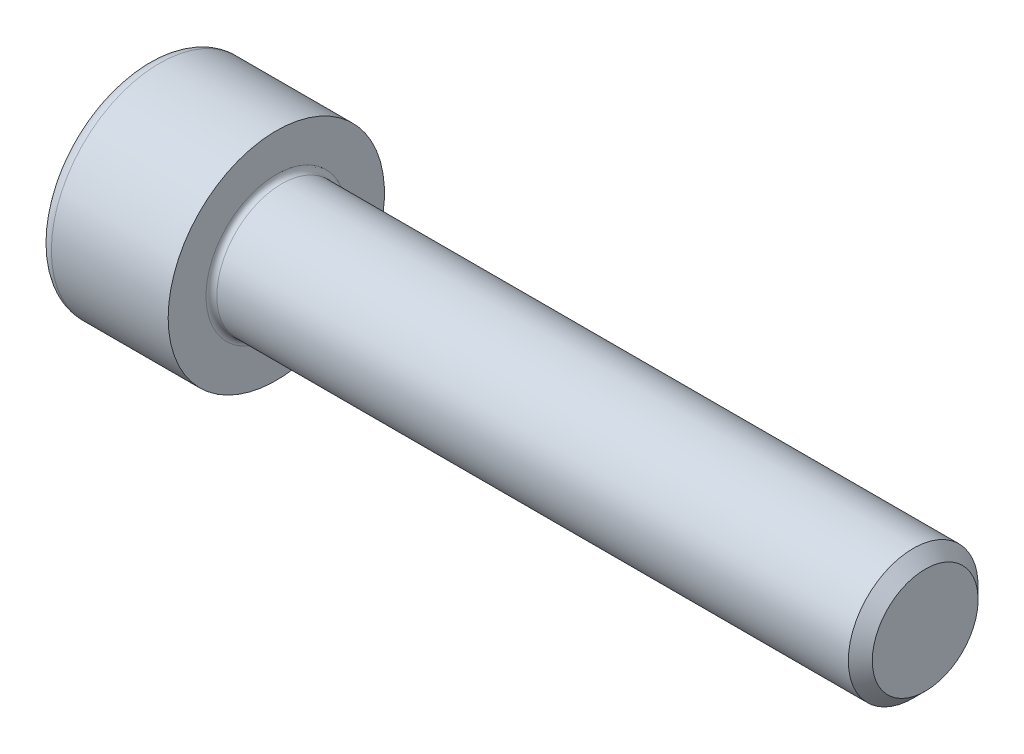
SolidWorks part; units mm, degrees
revolve "Base-Revolve" add sketch "BodySke" angle 360 about L6
sketch "BodySke" plane through (0, 0, 0) normal (0, 0, 1) x (1, 0, 0)
  line L0 (0, 0) -> (0, 5)
  line L1 (0, 5) -> (6, 5)
  line L2 (6, 5) -> (6, 3)
  line L3 (6, 3) -> (35.4455, 3)
  line L4 (36, 2.4455) -> (36, 0)
  line L5 (36, 0) -> (0, 0)
  line L6 (-31.75, 0) -> (127, 0) construction
  line L8 (36, 2.4455) -> (35.4455, 3)
  line L10 (36, -2.4455) -> (35.4455, -3) construction
  line L11 (7, 9.525) -> (7, 3.175) construction
  line L12 (6, 9.525) -> (6, 3.175) construction
  line L13 (-24, 9.525) -> (-24, 3.175) construction
  dimension "Diameter" = 6
  dimension "Head_ht" = 6
  dimension "Length" = 30
  dimension "Body_ch_ang" = 45
  dimension "Head_dia" = 10
  dimension "Minor_dia" = 4.891
  dimension "Advance" = 1
  dimension "Thread_nom" = 30
  dimension "Thread_length" = 60
fillet "Fillet2" radius 0.6 1 edges at (0, 0, 5)
ref_plane "Plane1" through (0, 0, 0) normal (0, 0, 1) x (1, 0, 0)
ref_plane "Plane2" through (0, 0, 0) normal (0, 1, 0) x (1, 0, 0)
ref_plane "Plane3" through (0, 0, 0) normal (1, 0, 0) x (0, 0, -1)
fillet "Fillet1" radius 0.25 1 edges at (6, 0, 3)
sketch "Sketch2" plane through (0, 0, 0) normal (0, 0, 1) x (1, 0, 0)
  line L0 (0, 2.51) -> (3, 2.51)
  line L1 (3, 2.51) -> (4.4491, 0)
  line L2 (-31.75, 0) -> (127, 0) construction
  line L3 (4.4491, 0) -> (0, 0)
  line L4 (0, 0) -> (0, 2.51)
  line L6 (0, 0) -> (47.625, 0) construction
revolve "Hex-PreBroach" cut sketch "Sketch2" angle 360 about L6
sketch "Sketch3" plane through (0, 0, 0) normal (-1, 0, 0) x (0, 0.5, 0.866)
  line L0 (1.4491, 2.51) -> (-1.4491, 2.51)
  line L1 (-1.4491, 2.51) -> (-2.8983, 0)
  line L2 (1.4491, 2.51) -> (2.8983, 0)
  line L3 (1.4491, -2.51) -> (2.8983, 0)
  line L4 (1.4491, -2.51) -> (-1.4491, -2.51)
  line L5 (-1.4491, -2.51) -> (-2.8983, 0)
extrude "Hex" cut sketch "Sketch3" against normal blind 3
sketch "ThdSchSke" plane through (0, 0, 0) normal (0, 0, 1) x (1, 0, 0)
  line L0 (9, -2.4455) -> (8.6117, -3)
  line L1 (9, -2.4455) -> (9.3883, -3)
  line L2 (9.3883, -3) -> (9.3883, -3.75)
  line L3 (-3.175, 0) -> (5.1513, 0) construction
  line L4 (0, 4.4) -> (0, -4.4) construction
  line L5 (9.3883, -3.75) -> (8.6117, -3.75)
  line L6 (8.6117, -3.75) -> (8.6117, -3)
revolve "ThreadSchematic" [suppressed] cut sketch "ThdSchSke" angle 360 about L3
pattern_linear "ThdSchPat" [suppressed]
thread "Filetage1" pitch 1 start angle 0, offset 3.5, length 30, pitch 1, diameter 6
ref_plane "Plan1" through (38.9455, 0, 3) normal (0, -1, 0) x (0, 0, 1)
sketch "Profil de filetage1" plane through (38.9455, 0, 3) normal (0, -1, 0) x (0, 0, 1)
  line L0 (0, 0) -> (0, 1) construction
  line L11 (0, 0) -> (0, 0.875)
  line L12 (0, 0.875) -> (-0.5413, 0.5625)
  line L13 (-0.5413, 0.5625) -> (-0.5413, 0.3125)
  line L15 (-0.5413, 0.3125) -> (0, 0)
  line L17 (-0.5413, 0.4375) -> (0, 0.4375) construction
  point P2 (0, 0)
  dimension "Pitch" = 1
  dimension "Profile_Angle" = 60
  dimension "Profile_Land" = 0.25
  dimension "Profile_Height" = 0.5413
equation "\"D2@Sketch3\" = \"Hex_size@Sketch3\" / 2"
equation "\"D1@Sketch3\" = \"Hex_size@Sketch3\" / 2"
equation "\"D1@Sketch2\" = \"Hex_size@Sketch3\" / 2"
equation "\"Depth@Sketch2\" =  \"Key_eng@Hex\""
equation "\"Thread_minor@ThdSchSke\" = \"Minor_dia@BodySke\""
equation "\"Diameter@ThdSchSke\" = \"Diameter@BodySke\""
equation "\"Overcut@ThdSchSke\" = \"Diameter@BodySke\" * 1.25"
